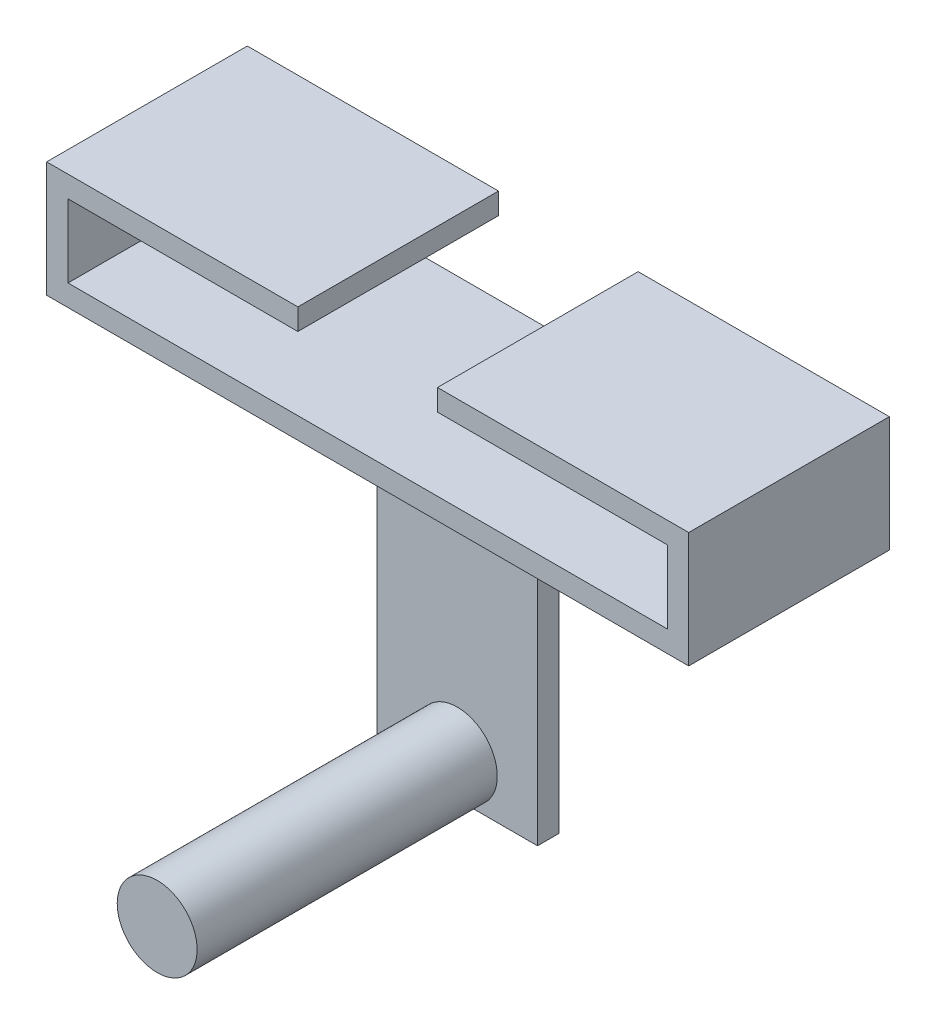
SolidWorks part; units mm, degrees
ref_plane "Front Plane" through (0, 0, 0) normal (0, 0, 1) x (1, 0, 0)
ref_plane "Top Plane" through (0, 0, 0) normal (0, 1, 0) x (1, 0, 0)
ref_plane "Right Plane" through (0, 0, 0) normal (1, 0, 0) x (0, 0, -1)
sketch "Sketch1" plane through (0, 0, 0) normal (0, 1, 0) x (1, 0, 0)
  line L1 (0, 0) -> (101.6, 0)
  line L2 (0, 0) -> (0, 31.75)
  line L3 (0, 31.75) -> (101.6, 31.75)
  line L4 (101.6, 0) -> (101.6, 31.75)
extrude "Boss-Extrude1" add sketch "Sketch1" along normal blind 18.288 contours L3 L4 L1 L2
sketch "Sketch2" plane through (0, 18.288, 0) normal (0, 1, 0) x (1, 0, 0)
  line L0 (0, 31.75) -> (101.6, 31.75) construction
  line L4 (39.751, 0) -> (39.751, 31.75)
  line L5 (0, 0) -> (101.6, 0) construction
  line L9 (61.849, 31.75) -> (61.849, 0)
  line L11 (39.751, 0) -> (61.849, 0)
  line L13 (39.751, 31.75) -> (61.849, 31.75)
extrude "Cut-Extrude1" cut sketch "Sketch2" against normal blind 14.9098
sketch "Sketch3" plane through (0, 0, 0) normal (0, 0, 1) x (1, 0, 0)
  line L0 (50.8, 3.3782) -> (50.8, 29.1234) construction
  line L1 (39.751, 3.3782) -> (3.3782, 3.3782)
  line L2 (39.751, 3.3782) -> (39.751, 14.9098)
  line L3 (39.751, 14.9098) -> (3.3782, 14.9098)
  line L4 (3.3782, 3.3782) -> (3.3782, 14.9098)
  line L5 (39.751, 3.3782) -> (61.849, 3.3782) construction
  line L6 (50.8, 29.1234) -> (50.8, -16.1656) construction
  line L7 (61.849, 14.9098) -> (98.2218, 14.9098)
  line L8 (98.2218, 3.3782) -> (98.2218, 14.9098)
  line L9 (61.849, 3.3782) -> (98.2218, 3.3782)
  line L10 (61.849, 3.3782) -> (61.849, 14.9098)
  dimension "D1" = 3.3782
  dimension "D2" = 3.3782
extrude "Cut-Extrude2" cut sketch "Sketch3" against normal through all
sketch "Sketch4" plane through (0, 0, 0) normal (0, -1, 0) x (1, 0, 0)
  line L0 (0, 0) -> (101.6, 0) construction
  line L1 (63.4898, -17.5641) -> (38.1102, -17.5641)
  line L2 (63.4898, -17.5641) -> (63.4898, -14.1859)
  line L3 (63.4898, -14.1859) -> (38.1102, -14.1859)
  line L4 (38.1102, -17.5641) -> (38.1102, -14.1859)
  line L5 (0, 0) -> (0, -31.75) construction
  point P4 (0, -15.875)
  point P5 (50.8, 0)
  point P6 (50.8, -14.1859)
  point P11 (38.1102, -15.875)
extrude "Boss-Extrude2" add sketch "Sketch4" along normal blind 50.8
sketch "Sketch5" plane through (0, 0, -14.1859) normal (0, 0, 1) x (1, 0, 0)
  line L0 (44.4754, -44.45) -> (57.1246, -44.45)
  arc A0 (57.1246, -44.45) -> (44.4754, -44.45) centre (50.8, -44.45) ccw
extrude "Boss-Extrude3" add sketch "Sketch5" along normal blind 47.498 contours L0 A0
sketch "Sketch8" plane through (0, 0, -14.1859) normal (0, 0, 1) x (1, 0, 0)
  line L0 (44.4754, -44.45) -> (57.1246, -44.45) construction
  line L1 (44.4754, -44.45) -> (57.1246, -44.45)
  arc A0 (44.4754, -44.45) -> (57.1246, -44.45) centre (50.8, -44.45) ccw
extrude "Boss-Extrude4" add sketch "Sketch8" along normal blind 47.498
equation "\"a\"= 1.006"
equation "\"b\"=0.9992"
equation "\"c\"= 0.133"
equation "\"d\"= 0.050"
equation "\"e\"=0.498"
equation "\"Overall Width\"= 4"
equation "\"width\"= 1.25"
equation "\"cylindrical diameter\"= 1.50"
equation "\"c beam length\"= 4'd"
equation "\"d beam length\"= 1"
equation "\"d beam width\"= 1.25"
equation "\"D1@Sketch1\"=\"Overall Width\""
equation "\"D2@Sketch1\"=\"width\""
equation "\"depth\"= 0.720"
equation "\"D1@Boss-Extrude1\"=\"depth\""
equation "\"cut length\"= 0.87"
equation "\"D1@Sketch2\"=\"cut length\""
equation "\"D1@Sketch4\"=\"b\""
equation "\"D2@Sketch4\"=\"c\""
equation "\"D1@Sketch5\"=\"e\""
